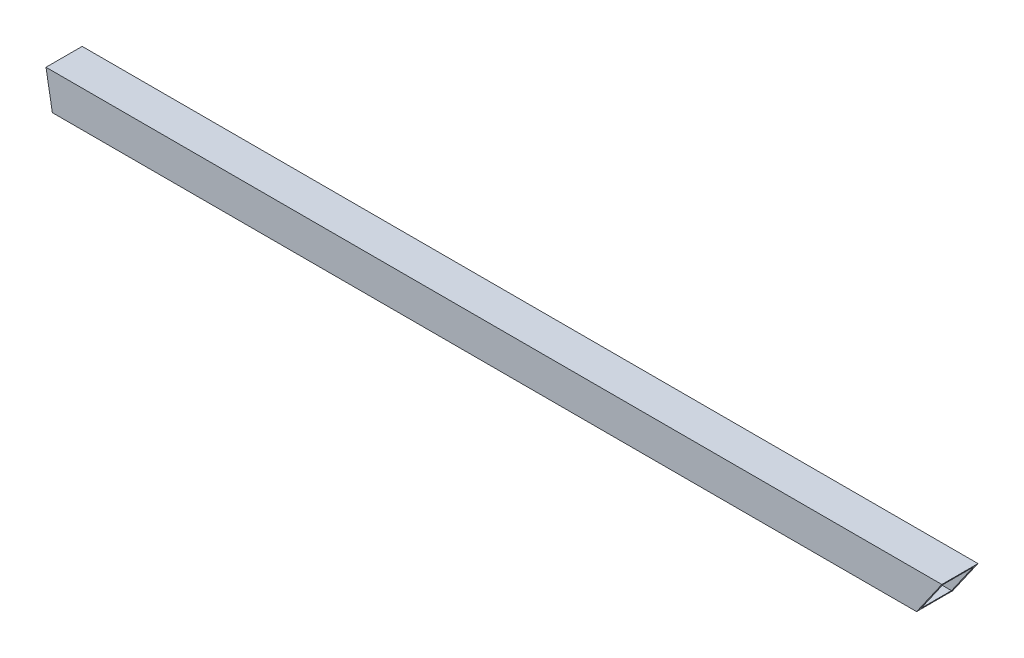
SolidWorks part; units mm, degrees
ref_plane "Plan de face" through (0, 0, 0) normal (0, 0, 1) x (1, 0, 0)
ref_plane "Plan de dessus" through (0, 0, 0) normal (0, 1, 0) x (1, 0, 0)
ref_plane "Plan de droite" through (0, 0, 0) normal (1, 0, 0) x (0, 0, -1)
sketch "Esquisse1" plane through (0, 0, 0) normal (0, 0, 1) x (1, 0, 0)
  line L0 (20.783, 0) -> (640, 0)
  line L1 (640, 0) -> (622.5501, -25)
  line L2 (622.5501, -25) -> (25.1742, -25)
  line L3 (25.1742, -25) -> (20.783, 0)
  line L5 (781.9384, -389.9724) -> (640, 0) construction
  line L6 (622.5501, -25) -> (757.7484, -396.4541) construction
  point P10 (330.3915, 0)
  dimension "D1" = 25
extrude "Boss.-Extru.1" add sketch "Esquisse1" along normal blind 25
sketch "Esquisse2" plane through (430.3396, -300.3751, 0) normal (0.82, -0.5724, 0) x (0, 0, -1)
  line L0 (-25, 335.8219) -> (-25, 366.3095) construction
  line L1 (-23, 337.8219) -> (-2, 337.8219)
  line L2 (-23, 337.8219) -> (-23, 364.3095)
  line L3 (-23, 364.3095) -> (-2, 364.3095)
  line L4 (-2, 337.8219) -> (-2, 364.3095)
  line L5 (-25, 366.3095) -> (0, 366.3095) construction
  line L6 (0, 335.8219) -> (0, 366.3095) construction
  line L7 (-25, 335.8219) -> (0, 335.8219) construction
  point P10 (0, 351.0657)
  dimension "D1" = 2
  dimension "D2" = 2
  dimension "D3" = 2
  dimension "D4" = 2
extrude "Enlèv. mat.-Extru.1" cut sketch "Esquisse2" along direction (-1, 0, 0) on the side against the normal through all
